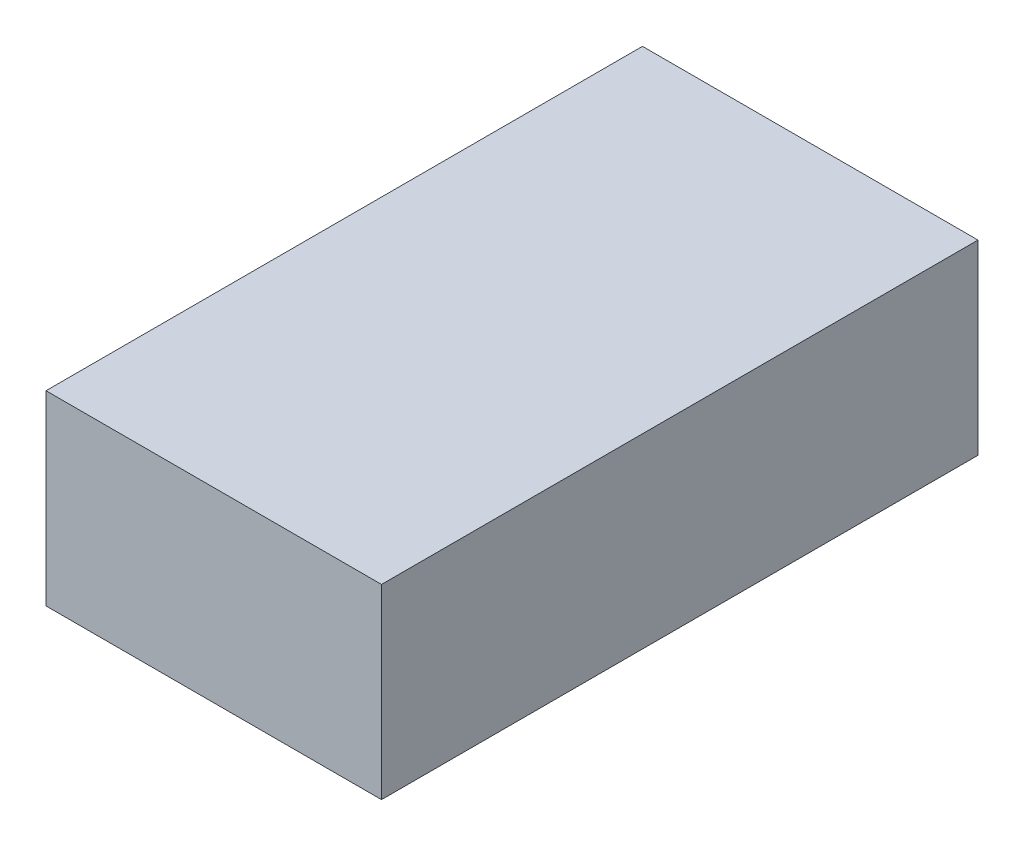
SolidWorks part; units mm, degrees
ref_plane "Front Plane" through (0, 0, 0) normal (0, 0, 1) x (1, 0, 0)
ref_plane "Top Plane" through (0, 0, 0) normal (0, 1, 0) x (1, 0, 0)
ref_plane "Right Plane" through (0, 0, 0) normal (1, 0, 0) x (0, 0, -1)
sketch "Sketch1" plane through (0, 0, 0) normal (0, 0, 1) x (1, 0, 0)
  line L1 (-28.575, -15.875) -> (28.575, -15.875)
  line L2 (-28.575, -15.875) -> (-28.575, 15.875)
  line L3 (-28.575, 15.875) -> (28.575, 15.875)
  line L4 (28.575, -15.875) -> (28.575, 15.875)
  line L5 (-28.575, -15.875) -> (28.575, 15.875) construction
  line L6 (-28.575, 15.875) -> (28.575, -15.875) construction
  point P0 (0, 0)
  dimension "D1" = 31.75
  dimension "D2" = 57.15
extrude "Boss-Extrude1" add sketch "Sketch1" along normal blind 101.6
